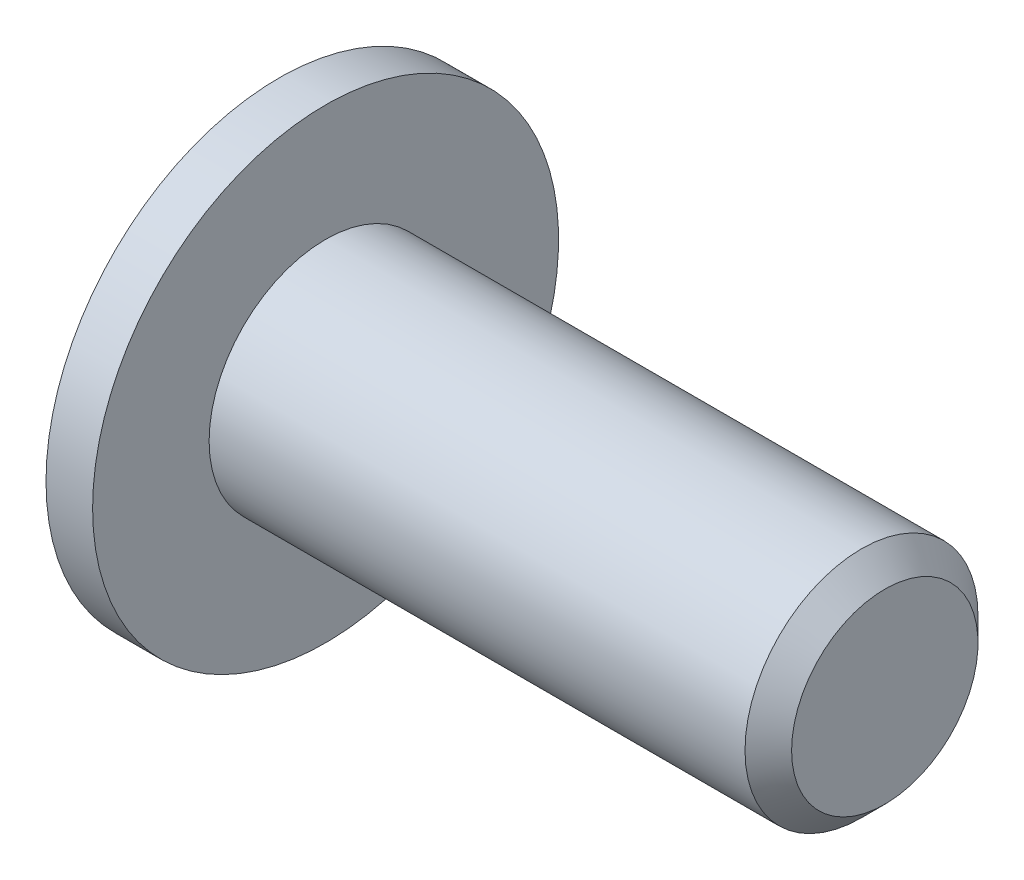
SolidWorks part; units mm, degrees
ref_plane "Ebene vorne" through (0, 0, 0) normal (0, 0, 1) x (1, 0, 0)
ref_plane "Ebene oben" through (0, 0, 0) normal (0, 1, 0) x (1, 0, 0)
ref_plane "Ebene rechts" through (0, 0, 0) normal (1, 0, 0) x (0, 0, -1)
sketch "Skizze1" plane through (0, 0, 0) normal (0, 0, 1) x (1, 0, 0)
  line L0 (0, 0) -> (40.2748, 0) construction
  line L1 (12, 0) -> (12, 2.5)
  line L2 (12, 2.5) -> (0, 2.5)
  line L3 (0, 2.5) -> (0, 5)
  line L4 (0, 5) -> (-1, 5)
  line L5 (-1, 5) -> (-1, 3.5707)
  line L6 (-2.5, 0) -> (12, 0)
  line L7 (-2.5, 0) -> (-2.5, -5.4221) construction
  arc A0 (-1, 3.5707) -> (-2.5, 0) centre (2.5, 0) ccw
  dimension "D1" = 5
  dimension "D5" = 5
  dimension "D2" = 12
  dimension "D3" = 1
  dimension "D4" = 2.5
  dimension "D6" = 10
revolve "Rotation1" add sketch "Skizze1" angle 360 about L0
chamfer "Fase1" distance 0.5 angle 45 1 edges at (12, 0, 2.5)
sketch "Skizze2" plane through (0, 0, 0) normal (1, 0, 0) x (0, 0, -1)
  line L1 (0, 1.7321) -> (-1.5, 0.866)
  line L2 (-1.5, 0.866) -> (-1.5, -0.866)
  line L3 (-1.5, -0.866) -> (0, -1.7321)
  line L4 (0, -1.7321) -> (1.5, -0.866)
  line L5 (1.5, -0.866) -> (1.5, 0.866)
  line L6 (1.5, 0.866) -> (0, 1.7321)
  circle A0 centre (0, 0) radius 1.5 construction
  dimension "D1" = 3
extrude "Schnitt-Linear austragen1" cut sketch "Skizze2" against normal through all from offset 1
